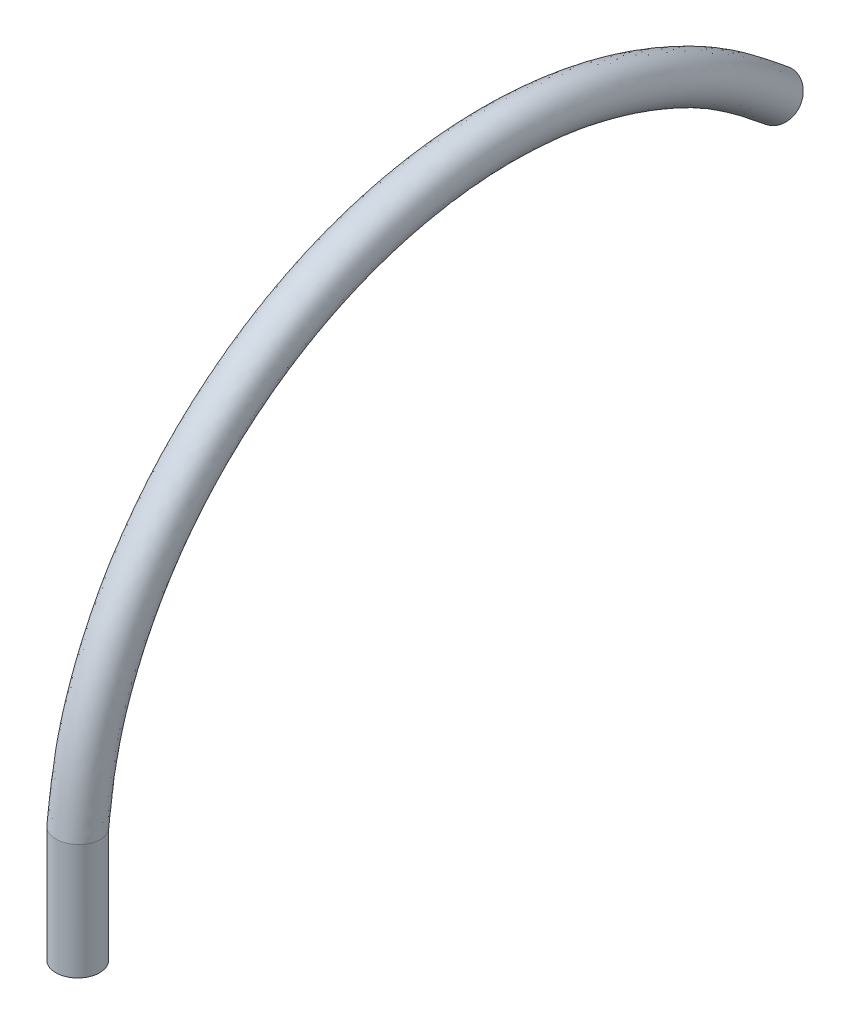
SolidWorks part; units mm, degrees
ref_plane "Front Plane" through (0, 0, 0) normal (0, 0, 1) x (1, 0, 0)
ref_plane "Top Plane" through (0, 0, 0) normal (0, 1, 0) x (1, 0, 0)
ref_plane "Right Plane" through (0, 0, 0) normal (1, 0, 0) x (0, 0, -1)
sketch "Sketch1" plane through (0, 0, 0) normal (1, 0, 0) x (0, 0, -1)
  line L0 (0, 0) -> (0, 16.6751)
  arc A0 (0, 16.6751) -> (101.352, 57.8494) centre (60.8678, 12.1748) cw
sketch "Sketch2" plane through (0, 0, 0) normal (0, 1, 0) x (1, 0, 0)
  circle A0 centre (0, 0) radius 3.175
  dimension "D1" = 6.35
sweep "Sweep6" add profiles "Sketch2" path "Sketch1"
